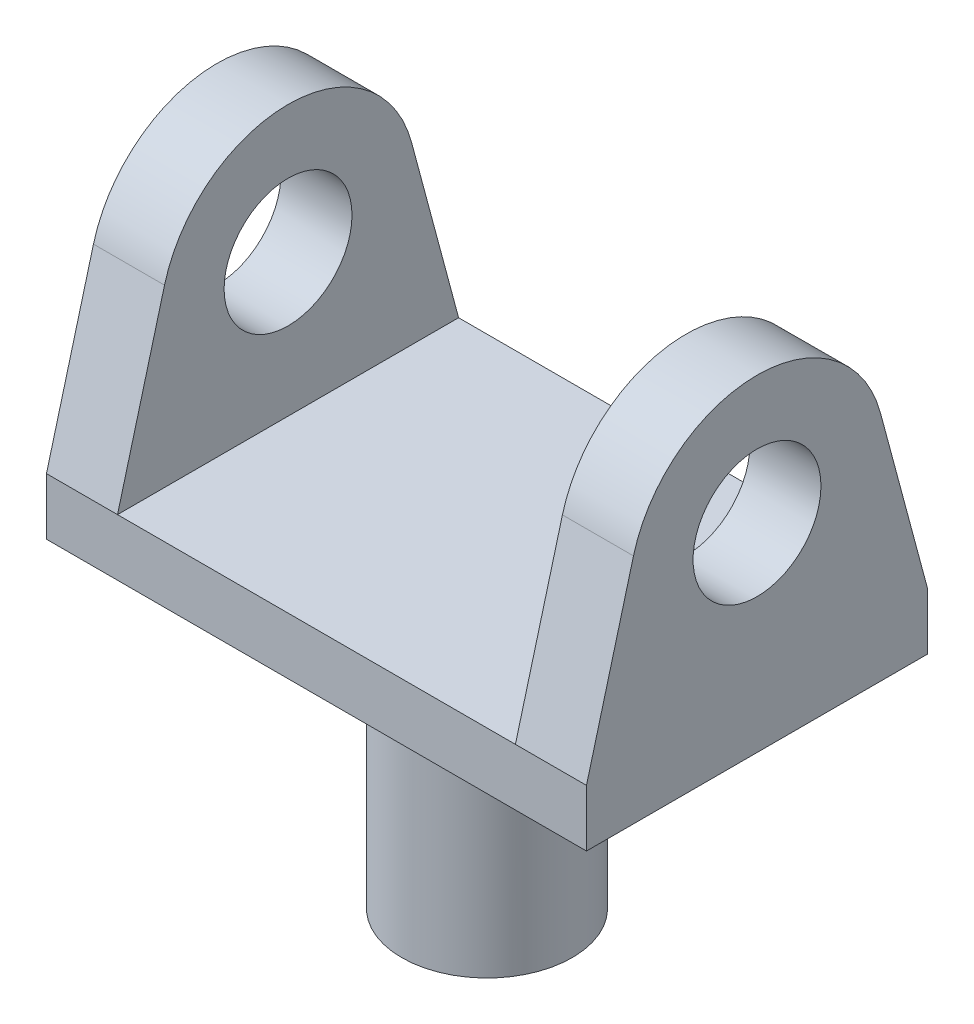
SolidWorks part; units mm, degrees
ref_plane "Front Plane" through (0, 0, 0) normal (0, 0, 1) x (1, 0, 0)
ref_plane "Top Plane" through (0, 0, 0) normal (0, 1, 0) x (1, 0, 0)
ref_plane "Right Plane" through (0, 0, 0) normal (1, 0, 0) x (0, 0, -1)
imported_body "Imported3"
ref_plane "Plane1" through (-14, 0, 0) normal (-1, 0, 0) x (0, -1, 0)
sketch "Sketch1" plane through (-14, 0, 0) normal (-1, 0, 0) x (0, -1, 0)
  spline S0 degree 3 poles (-4, 12) (-8.1105, 10.8976) (-12.2209, 9.7953) (-16.3313, 8.6928) knots 0 0 0 0 1 1 1 1
  spline S1 degree 3 poles (-16.3313, 8.6928) (-23.9561, 6.6474) (-23.9564, -6.6476) (-16.3314, -8.6928) knots 0 0 0 0 1 1 1 1
  spline S2 degree 3 poles (-16.3314, -8.6928) (-12.2209, -9.7952) (-8.1105, -10.8976) (-4, -12) knots 0 0 0 0 1 1 1 1
  spline S3 degree 3 poles (-4, -12) (-4, -4) (-4, 4) (-4, 12) knots 0 0 0 0 1 1 1 1
extrude "Cut-Extrude1" cut sketch "Sketch1" against normal blind 28
ref_plane "Plane2" through (0, 0, 0) normal (0, 0, -1) x (-1, 0, 0)
sketch "Sketch2" plane through (0, 0, 0) normal (0, 0, -1) x (-1, 0, 0)
  line L0 (-6, -19) -> (0, -19)
  line L1 (0, -19) -> (0, 0)
  line L2 (0, 0) -> (-6, 0)
  line L3 (-6, 0) -> (-6, -19)
  line L4 (0, -19.0027) -> (0, 0) construction
  point P7 (0, 0)
  dimension "D1" = 6
revolve "Revolve1" add sketch "Sketch2" angle 360 about L4
hole_wizard "Ø8.0 (8) Diameter Hole1" positions "Sketch4" profile "Sketch3" hole size "Ø8.0" standard "ANSI Metric"
sketch "Sketch4" plane through (0, -19, 0) normal (0, -1, 0) x (-1, 0, 0)
  point P0 (0, -0.3119)
sketch "Sketch3" plane through (0, -19, 0.3119) normal (1, 0, 0) x (0, 0, -1)
  line L0 (0, 0) -> (0, 19)
  line L1 (0, 19) -> (3, 19)
  line L2 (3, 19) -> (3, 0)
  line L5 (3, 0) -> (0, 0)
  line L10 (0, 19) -> (-3, 19) construction
  line L11 (0, -6.35) -> (0, 107.95) construction
  dimension "Hole Dia." = 6
  dimension "Hole Depth" = 19
  dimension "Drill Angle" = 180
hole_wizard "Ø9.0 (9) Diameter Hole2" positions "Sketch8" profile "Sketch7" hole size "Ø9.0" standard "ANSI Metric"
sketch "Sketch8" plane through (-19, 0, 0) normal (-1, 0, 0) x (0, 0, 1)
  point P0 (0, 14)
sketch "Sketch7" plane through (-19, 14, 0) normal (0, 1, 0) x (0, 0, 1)
  line L0 (0, 0) -> (0, 38.0014)
  line L1 (0, 38.0014) -> (4.5, 38.0014)
  line L2 (4.5, 38.0014) -> (4.5, 0)
  line L5 (4.5, 0) -> (0, 0)
  line L11 (0, -6.35) -> (0, 107.95) construction
  dimension "Thru Hole Dia." = 9
  dimension "Thru Hole Depth" = 38.0014
hole_wizard "Ø9.0 (9) Diameter Hole1" positions "Sketch6" profile "Sketch5" hole size "Ø9.0" standard "ANSI Metric"
sketch "Sketch6" plane through (19, 0, 0) normal (1, 0, 0) x (0, 0, -1)
  point P0 (0, 14)
sketch "Sketch5" plane through (19, 14, 0) normal (0, 1, 0) x (0, 0, -1)
  line L0 (0, 0) -> (0, 38.0015)
  line L1 (0, 38.0015) -> (4.5, 38.0015)
  line L2 (4.5, 38.0015) -> (4.5, 0)
  line L5 (4.5, 0) -> (0, 0)
  line L11 (0, -6.35) -> (0, 107.95) construction
  dimension "Thru Hole Dia." = 9
  dimension "Thru Hole Depth" = 38.0015
sketch "Sketch9" plane through (0, 0, -12) normal (0, 0, -1) x (-1, 0, 0)
  line L1 (-14, 26.6484) -> (14, 26.6484)
  line L2 (-14, 26.6484) -> (-14, 16.3314)
  line L3 (-14, 16.3314) -> (14, 16.3314)
  line L4 (14, 26.6484) -> (14, 16.3314)
  point P6 (-14.1062, 26.6484)
  point P7 (0, 0)
extrude "Cut-Extrude2" cut sketch "Sketch9" against normal through all
